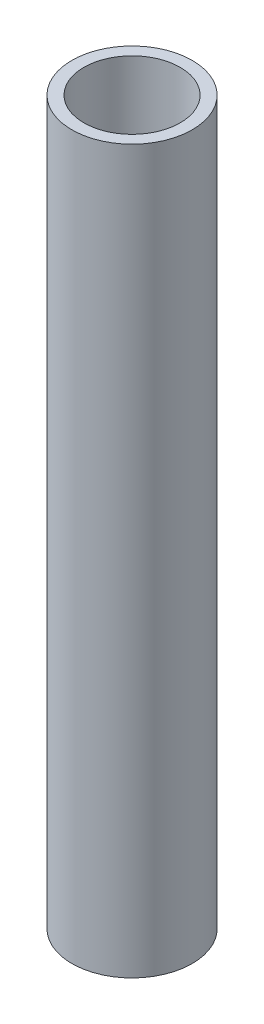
SolidWorks part; units mm, degrees
ref_plane "Front Plane" through (0, 0, 0) normal (0, 0, 1) x (1, 0, 0)
ref_plane "Top Plane" through (0, 0, 0) normal (0, 1, 0) x (1, 0, 0)
ref_plane "Right Plane" through (0, 0, 0) normal (1, 0, 0) x (0, 0, -1)
sketch "Sketch1" plane through (0, 0, 0) normal (0, 1, 0) x (1, 0, 0)
  circle A0 centre (0, 0) radius 12.7
  circle A1 centre (0, 0) radius 10.16
  dimension "D1" = 25.4
  dimension "D2" = 2.54
extrude "Boss-Extrude1" add sketch "Sketch1" along normal blind 152.4
